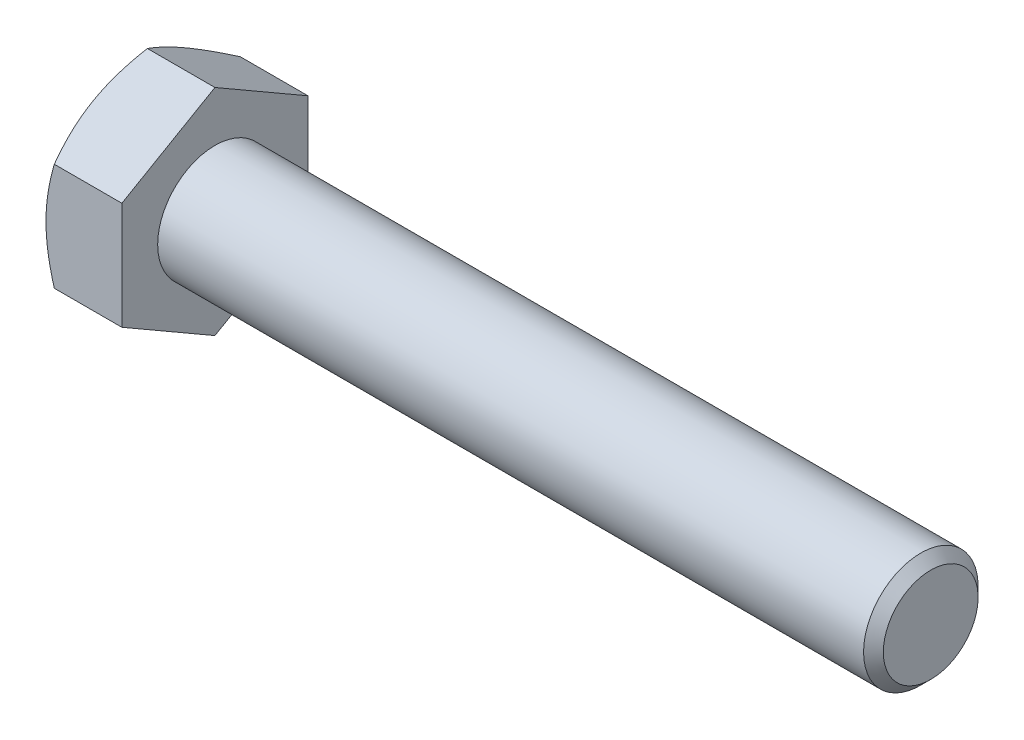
SolidWorks part; units mm, degrees
ref_plane "Plane1" through (0, 0, 0) normal (0, 0, 1) x (1, 0, 0)
ref_plane "Plane2" through (0, 0, 0) normal (0, 1, 0) x (1, 0, 0)
ref_plane "Plane3" through (0, 0, 0) normal (1, 0, 0) x (0, 0, -1)
sketch "Sketch1" plane through (0, 0, 0) normal (1, 0, 0) x (0, 0, -1)
  line L0 (6.5, 3.7528) -> (6.5, -3.7528)
  line L1 (-6.5, 3.7528) -> (-6.5, -3.7528)
  line L2 (6.5, -3.7528) -> (0, -7.5056)
  line L3 (0, -7.5056) -> (-6.5, -3.7528)
  line L4 (6.5, 3.7528) -> (0, 7.5056)
  line L5 (0, 7.5056) -> (-6.5, 3.7528)
  dimension "Width_flats" = 13
  dimension "D2" = 120
  dimension "D3" = 6.5
  dimension "D4" = 6.5
  dimension "D5" = 6.5
extrude "BaseHead" add sketch "Sketch1" along normal blind 5.3
sketch "BodySke" plane through (0, 0, 0) normal (0, 0, 1) x (1, 0, 0)
  line L1 (0, 0) -> (55.3, 0)
  line L2 (0, 0) -> (0, 4)
  line L4 (55.3, 0) -> (55.3, 3.3095)
  line L5 (5.3, 7.5056) -> (5.3, 3.7528) construction
  line L6 (55.3, 3.3095) -> (54.6095, 4)
  line L7 (0, 0) -> (110.49, 0) construction
  line L8 (55.3, -3.3095) -> (54.6095, -4) construction
  line L9 (0, 3.7528) -> (0, -3.7528) construction
  line L10 (6.55, 15.24) -> (6.55, -1.27) construction
  line L11 (5.3, 15.24) -> (5.3, -1.27) construction
  line L12 (5.3, 3.7528) -> (5.3, -3.7528) construction
  line L15 (0, 4) -> (54.6095, 4)
  dimension "Length" = 50
  dimension "Body_ch_ang" = 45
  dimension "Diameter" = 8
  dimension "Minor_dia" = 6.619
  dimension "Advance" = 1.25
  dimension "Thread_nom" = 50
revolve "BaseBody" add sketch "BodySke" angle 360 about L7
fillet "HeadFillet" [suppressed] radius 0.4
sketch "Sketch3" plane through (0, 0, 0) normal (0, 0, 1) x (1, 0, 0)
  line L0 (0, 6.5) -> (3.4673, 12.5056)
  line L1 (0, 7.5056) -> (0, 3.7528) construction
  line L2 (3.4673, 12.5056) -> (3.4673, 17.5056)
  line L3 (3.4673, 17.5056) -> (-10, 17.5056)
  line L4 (-10, 17.5056) -> (-10, 6.5)
  line L5 (-10, 6.5) -> (0, 6.5)
  line L6 (0, 0) -> (99.06, 0) construction
  line L7 (5.3, 7.5056) -> (0, 7.5056) construction
  dimension "D1" = 6.5
  dimension "D2" = 5
  dimension "D3" = 10
  dimension "D4" = 5
  dimension "Head_ch_ang" = 30
revolve "HeadChamfer" cut sketch "Sketch3" angle 360 about L6
sketch "ThdSchSke" plane through (0, 0, 0) normal (0, 0, 1) x (1, 0, 0)
  line L0 (6.55, -3.3095) -> (6.0665, -4)
  line L1 (6.55, -3.3095) -> (7.0335, -4)
  line L2 (7.0335, -4) -> (7.0335, -5)
  line L3 (-3.175, 0) -> (5.1513, 0) construction
  line L5 (7.0335, -5) -> (6.0665, -5)
  line L6 (6.0665, -5) -> (6.0665, -4)
  dimension "Thread_minor" = 6.619
  dimension "Diameter" = 8
  dimension "Start" = 6.55
  dimension "SideAngle" = 55
  dimension "VeeAngle" = 70
  dimension "Overcut" = 10
revolve "ThreadSchematic" [suppressed] cut sketch "ThdSchSke" angle 360 about L3
pattern_linear "ThdSchPat" [suppressed]
equation "\"D3@Sketch1\" = \"Width_flats@Sketch1\" / 2"
equation "\"D4@Sketch1\" = \"D3@Sketch1\""
equation "\"D5@Sketch1\" = \"D4@Sketch1\""
equation "\"Thread_minor@ThreadCosmetic\" = \"Minor_dia@BodySke\""
equation "\"D1@Sketch3\" = \"Width_flats@Sketch1\" / 2"
equation "\"Thread_length@ThreadCosmetic\" = ((sgn( (\"Length@BodySke\" - \"Advance@BodySke\" ) - \"Thread_nom@BodySke\" )-1)*( (\"Length@BodySke\" - \"Advance@BodySke\" ) - \"Thread_nom@BodySke\" ))/-2+ \"Thread_nom@BodySke\""
equation "\"Thread_minor@ThdSchSke\" = \"Minor_dia@BodySke\""
equation "\"Diameter@ThdSchSke\" = \"Diameter@BodySke\""
equation "\"Overcut@ThdSchSke\" = \"Diameter@BodySke\" * 1.25"
equation "\"Start@ThdSchSke\" = \"Head_ht@BaseHead\" + \"Length@BodySke\" - \"Thread_length@ThreadCosmetic\"  '---Non-countersunk---"
equation "\"Num_threads@ThdSchPat\" = int( \"Thread_length@ThreadCosmetic\" / \"Advance@BodySke\" + 0.999 )  + 1"
equation "\"Advance@ThdSchPat\" = \"Thread_length@ThreadCosmetic\" /  (\"Num_threads@ThdSchPat\" - 1) 'relax it"
equation "\"Num_threads@ThdSchPat\" = \"Num_threads@ThdSchPat\" - sgn( \"Num_threads@ThdSchPat\" - 1) '---chamfered tips only---"
